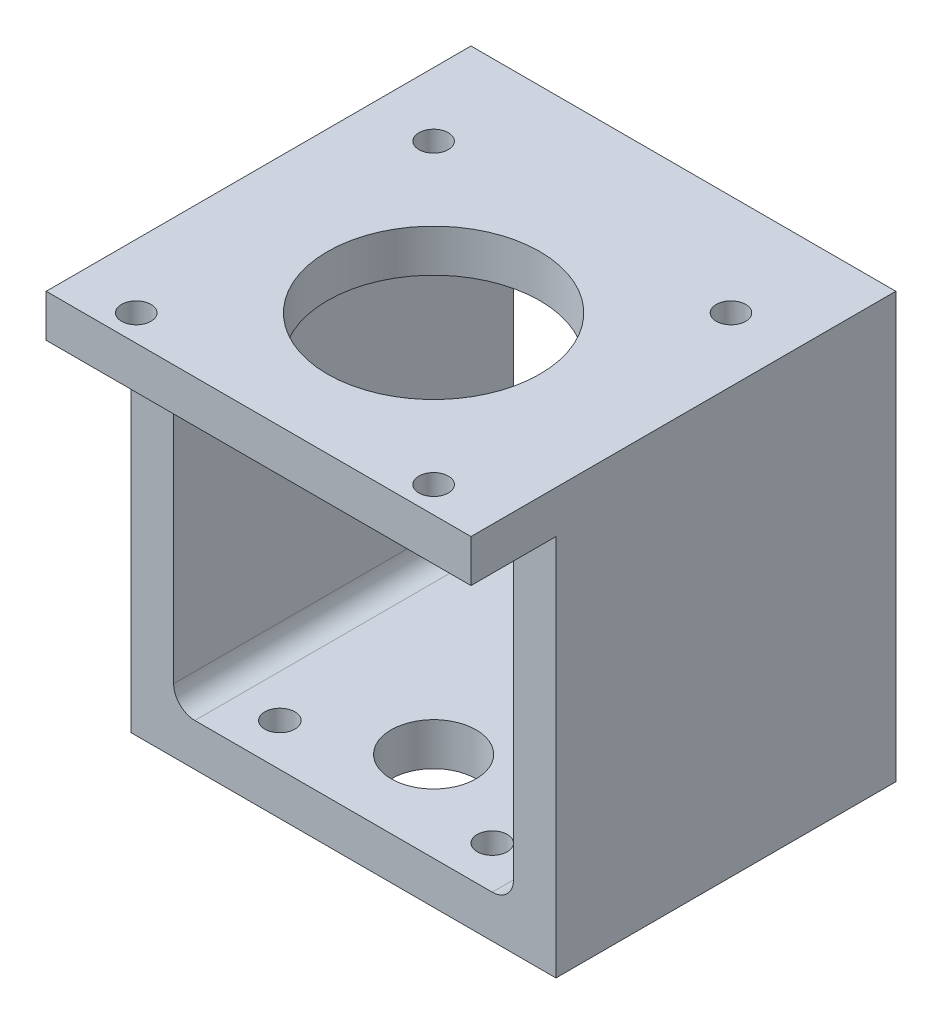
SolidWorks part; units mm, degrees
ref_plane "Front Plane" through (0, 0, 0) normal (0, 0, 1) x (1, 0, 0)
ref_plane "Top Plane" through (0, 0, 0) normal (0, 1, 0) x (1, 0, 0)
ref_plane "Right Plane" through (0, 0, 0) normal (1, 0, 0) x (0, 0, -1)
sketch "Sketch2" plane through (0, 0, 0) normal (0, 0, 1) x (1, 0, 0)
  line L1 (0, 0) -> (63.5, 0)
  line L2 (0, 0) -> (0, 63.5)
  line L3 (0, 63.5) -> (63.5, 63.5)
  line L4 (63.5, 0) -> (63.5, 63.5)
  line L5 (9.525, 57.15) -> (53.975, 57.15)
  line L6 (6.35, 53.975) -> (6.35, 9.525)
  line L7 (9.525, 6.35) -> (53.975, 6.35)
  line L8 (57.15, 53.975) -> (57.15, 9.525)
  arc A0 (9.525, 57.15) -> (6.35, 53.975) centre (9.525, 53.975) ccw
  arc A1 (53.975, 57.15) -> (57.15, 53.975) centre (53.975, 53.975) cw
  arc A2 (53.975, 6.35) -> (57.15, 9.525) centre (53.975, 9.525) ccw
  arc A3 (6.35, 9.525) -> (9.525, 6.35) centre (9.525, 9.525) ccw
  dimension "D7" = 3.175
  dimension "D1" = 63.5
  dimension "D2" = 63.5
  dimension "D3" = 6.35
  dimension "D4" = 6.35
  dimension "D5" = 6.35
  dimension "D6" = 6.35
extrude "Extrude2" add sketch "Sketch2" against normal blind 63.5
ref_plane "Plane1" through (31.75, 0, 0) normal (-1, 0, 0) x (0, 0, 1)
sketch "Sketch3" plane through (63.5, 0, 0) normal (1, 0, 0) x (0, 0, -1)
  line L1 (0, 0) -> (12.7, 0)
  line L2 (0, 0) -> (0, 57.15)
  line L3 (0, 57.15) -> (12.7, 57.15)
  line L4 (12.7, 0) -> (12.7, 57.15)
  dimension "D1" = 57.15
  dimension "D2" = 12.7
extrude "Extrude3" cut sketch "Sketch3" against normal through all
sketch "Sketch4" plane through (0, 63.5, 0) normal (0, 1, 0) x (-1, 0, 0)
  circle A0 centre (-31.75, -26.162) radius 15.875
  circle A1 centre (-31.75, -26.162) radius 15.875 construction
  dimension "D1" = 31.75
extrude "Cut-Extrude1" cut sketch "Sketch4" against normal up to surface (6.35 mm away)
sketch "Sketch5" plane through (0, 6.35, 0) normal (0, 1, 0) x (-1, 0, 0)
  circle A0 centre (-31.75, -26.162) radius 6.35
  circle A1 centre (-31.75, -26.162) radius 15.875 construction
  dimension "D1" = 12.7
extrude "Cut-Extrude2" cut sketch "Sketch5" against normal up to surface (6.35 mm away)
hole_wizard "Tap Drill for #8 Helicoil1" positions "3DSketch1" profile "Sketch6" hole size "#8-32" standard "Ansi Inch"
sketch3d "3DSketch1"
  circle A0 centre (9.525, 63.5, -48.387) radius 1.9844 construction
  circle A1 centre (53.975, 63.5, -48.387) radius 1.9844 construction
  circle A2 centre (53.975, 63.5, -3.937) radius 1.9844 construction
  circle A3 centre (9.525, 63.5, -3.937) radius 1.9844 construction
  point P0 (9.525, 63.5, -48.387)
  point P2 (9.525, 63.5, -3.937)
  point P4 (53.975, 63.5, -48.387)
  point P6 (53.975, 63.5, -3.937)
  point P12 (9.525, 61.5156, -48.387)
  point P15 (53.975, 61.5156, -48.387)
  point P18 (53.975, 61.5156, -3.937)
  point P21 (9.525, 61.5156, -3.937)
sketch "Sketch6" plane through (9.525, 63.5, -48.387) normal (1, 0, 0) x (0, 0, 1)
  line L0 (0, 0) -> (0, 10.4642)
  line L1 (0, 10.4642) -> (2.1971, 9.144)
  line L2 (2.1971, 9.144) -> (2.1971, 0)
  line L5 (2.1971, 0) -> (0, 0)
  line L10 (0, 10.4642) -> (-2.1971, 9.144) construction
  line L11 (0, -6.35) -> (0, 107.95) construction
  dimension "Hole Dia." = 4.3942
  dimension "Hole Depth" = 9.144
  dimension "Drill Angle" = 118
hole_wizard "#8 Clearance Hole1" positions "3DSketch2" profile "Sketch7" hole size "#8" standard "Ansi Inch"
sketch3d "3DSketch2"
  line L1 (15.875, 0, -19.05) -> (15.875, 0, -57.15) construction
  line L2 (15.875, 0, -19.05) -> (47.625, 0, -19.05) construction
  line L3 (47.625, 0, -19.05) -> (47.625, 0, -57.15) construction
  line L4 (15.875, 0, -57.15) -> (47.625, 0, -57.15) construction
  line L5 (0, 0, -63.5) -> (0, 0, -12.7) construction
  line L6 (63.5, 0, -63.5) -> (63.5, 0, -12.7) construction
  line L7 (0, 0, -63.5) -> (63.5, 0, -63.5) construction
  line L8 (0, 0, -12.7) -> (63.5, 0, -12.7) construction
  point P0 (15.875, 0, -19.05)
  point P116 (15.875, 0, -57.15)
  point P118 (47.625, 0, -57.15)
  point P120 (47.625, 0, -19.05)
  dimension "D1" = 15.875
  dimension "D2" = 15.875
  dimension "D3" = 6.35
  dimension "D4" = 6.35
sketch "Sketch7" plane through (15.875, 0, -19.05) normal (1, 0, 0) x (0, 0, -1)
  line L0 (0, 0) -> (0, 10.4947)
  line L1 (0, 10.4947) -> (2.2479, 9.144)
  line L2 (2.2479, 9.144) -> (2.2479, 0)
  line L5 (2.2479, 0) -> (0, 0)
  line L10 (0, 10.4947) -> (-2.2479, 9.144) construction
  line L11 (0, -6.35) -> (0, 107.95) construction
  dimension "Hole Dia." = 4.4958
  dimension "Hole Depth" = 9.144
  dimension "Drill Angle" = 118
hole_wizard "Tap Drill for #4 Helicoil1" positions "3DSketch4" profile "Sketch9" hole size "#4-40" standard "Ansi Inch"
sketch3d "3DSketch4"
  line L18 (60.325, 60.325, -63.5) -> (3.175, 60.325, -63.5) construction
  line L19 (60.325, 60.325, -63.5) -> (60.325, 3.175, -63.5) construction
  line L20 (60.325, 3.175, -63.5) -> (3.175, 3.175, -63.5) construction
  line L21 (3.175, 60.325, -63.5) -> (3.175, 3.175, -63.5) construction
  line L22 (63.5, 63.5, -63.5) -> (0, 63.5, -63.5) construction
  line L23 (0, 0, -63.5) -> (63.5, 0, -63.5) construction
  line L24 (0, 63.5, -63.5) -> (0, 0, -63.5) construction
  line L25 (63.5, 0, -63.5) -> (63.5, 63.5, -63.5) construction
  point P0 (60.325, 60.325, -63.5)
  point P2 (3.175, 60.325, -63.5)
  point P4 (3.175, 3.175, -63.5)
  point P6 (60.325, 3.175, -63.5)
  dimension "D1" = 3.175
  dimension "D2" = 3.175
  dimension "D3" = 3.175
  dimension "D4" = 3.175
sketch "Sketch9" plane through (60.325, 60.325, -63.5) normal (1, 0, 0) x (0, 1, 0)
  line L0 (0, 0) -> (0, 10.0597)
  line L1 (0, 10.0597) -> (1.524, 9.144)
  line L2 (1.524, 9.144) -> (1.524, 0)
  line L5 (1.524, 0) -> (0, 0)
  line L10 (0, 10.0597) -> (-1.524, 9.144) construction
  line L11 (0, -6.35) -> (0, 107.95) construction
  dimension "Hole Dia." = 3.048
  dimension "Hole Depth" = 9.144
  dimension "Drill Angle" = 118
